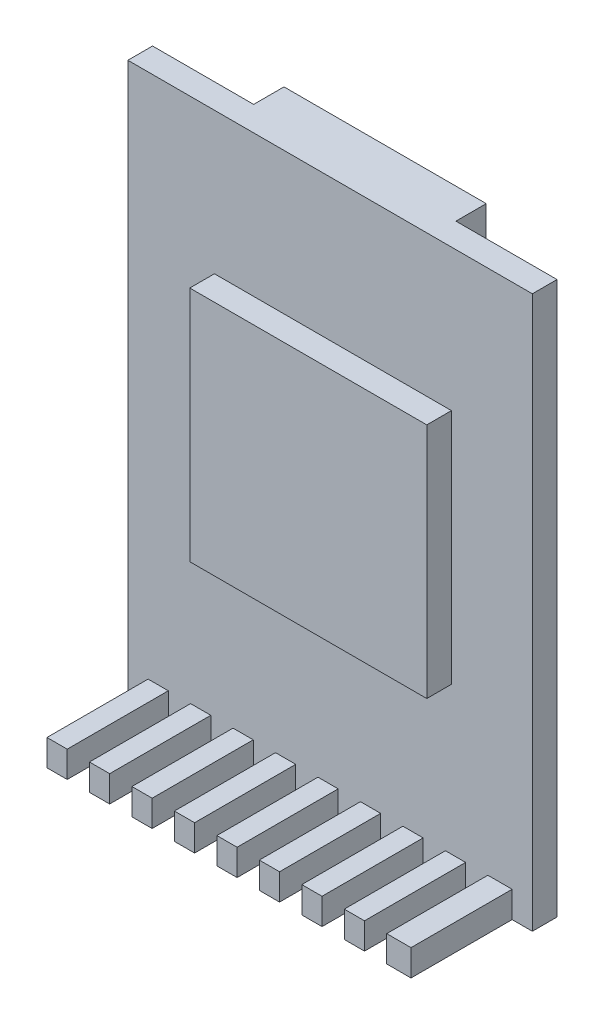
SolidWorks part; units mm, degrees
ref_plane "Front Plane" through (0, 0, 0) normal (0, 0, 1) x (1, 0, 0)
ref_plane "Top Plane" through (0, 0, 0) normal (0, 1, 0) x (1, 0, 0)
ref_plane "Right Plane" through (0, 0, 0) normal (1, 0, 0) x (0, 0, -1)
sketch "Sketch1" plane through (0, 0, 0) normal (0, 0, 1) x (1, 0, 0)
  line L1 (0, 0) -> (25.4, 0)
  line L2 (0, 0) -> (0, 34.671)
  line L3 (0, 34.671) -> (25.4, 34.671)
  line L4 (25.4, 0) -> (25.4, 34.671)
  dimension "D1" = 25.4
  dimension "D2" = 34.671
extrude "Boss-Extrude1" add sketch "Sketch1" along normal blind 1.5494
sketch "Sketch2" plane through (0, 0, 1.5494) normal (0, 0, 1) x (1, 0, 0)
  line L0 (25.4, 0) -> (25.4, 34.671) construction
  line L1 (5.4356, 25.7769) -> (20.32, 25.7769)
  line L2 (5.4356, 25.7769) -> (5.4356, 10.8925)
  line L3 (5.4356, 10.8925) -> (20.32, 10.8925)
  line L4 (20.32, 25.7769) -> (20.32, 10.8925)
  line L5 (5.4356, 25.7769) -> (20.32, 10.8925) construction
  line L6 (5.4356, 10.8925) -> (20.32, 25.7769) construction
  point P0 (12.8778, 18.3347)
  dimension "D1" = 14.8844
  dimension "D2" = 14.8844
  dimension "D3" = 5.08
extrude "Boss-Extrude2" add sketch "Sketch2" along normal blind 1.5494
sketch "Sketch3" plane through (0, 0, 1.5494) normal (0, 0, 1) x (1, 0, 0)
  line L0 (0, 0) -> (25.4, 0) construction
  line L1 (1.27, 0) -> (24.13, 0)
  line L2 (1.27, 0) -> (1.27, 1.651)
  line L3 (1.27, 1.651) -> (24.13, 1.651)
  line L4 (24.13, 0) -> (24.13, 1.651)
  line L5 (25.4, 0) -> (25.4, 34.671) construction
  dimension "D1" = 22.86
  dimension "D2" = 1.27
  dimension "D3" = 1.651
extrude "Boss-Extrude3" add sketch "Sketch3" along normal blind 6.35
sketch "Sketch4" plane through (0, 1.651, 0) normal (0, 1, 0) x (1, 0, 0)
  line L0 (24.13, -7.8994) -> (1.27, -7.8994) construction
  line L1 (2.54, -7.8994) -> (3.937, -7.8994)
  line L2 (2.54, -7.8994) -> (2.54, -1.5494)
  line L3 (2.54, -1.5494) -> (3.937, -1.5494)
  line L4 (3.937, -7.8994) -> (3.937, -1.5494)
  line L5 (24.13, -1.5494) -> (1.27, -1.5494) construction
  line L6 (25.4, -1.5494) -> (0, -1.5494) construction
  line L7 (5.207, -7.8994) -> (6.604, -7.8994)
  line L8 (5.207, -7.8994) -> (5.207, -1.5494)
  line L9 (5.207, -1.5494) -> (6.604, -1.5494)
  line L10 (6.604, -7.8994) -> (6.604, -1.5494)
  line L11 (1.27, -7.8994) -> (1.27, -1.5494) construction
  line L12 (20.32, -1.5494) -> (5.4356, -1.5494) construction
  line L13 (7.874, -7.8994) -> (9.271, -7.8994)
  line L14 (7.874, -7.8994) -> (7.874, -1.5494)
  line L15 (7.874, -1.5494) -> (9.271, -1.5494)
  line L16 (9.271, -7.8994) -> (9.271, -1.5494)
  line L18 (10.541, -7.8994) -> (11.938, -7.8994)
  line L19 (10.541, -7.8994) -> (10.541, -1.5494)
  line L20 (10.541, -1.5494) -> (11.938, -1.5494)
  line L21 (11.938, -7.8994) -> (11.938, -1.5494)
  line L22 (13.208, -7.8994) -> (14.605, -7.8994)
  line L23 (13.208, -7.8994) -> (13.208, -1.5494)
  line L24 (13.208, -1.5494) -> (14.605, -1.5494)
  line L25 (14.605, -7.8994) -> (14.605, -1.5494)
  line L26 (15.875, -7.8994) -> (17.272, -7.8994)
  line L27 (15.875, -7.8994) -> (15.875, -1.5494)
  line L28 (15.875, -1.5494) -> (17.272, -1.5494)
  line L29 (17.272, -7.8994) -> (17.272, -1.5494)
  line L30 (18.542, -7.8994) -> (19.939, -7.8994)
  line L31 (18.542, -7.8994) -> (18.542, -1.5494)
  line L32 (18.542, -1.5494) -> (19.939, -1.5494)
  line L33 (19.939, -7.8994) -> (19.939, -1.5494)
  line L34 (21.209, -7.8994) -> (22.606, -7.8994)
  line L35 (21.209, -7.8994) -> (21.209, -1.5494)
  line L36 (21.209, -1.5494) -> (22.606, -1.5494)
  line L37 (22.606, -7.8994) -> (22.606, -1.5494)
  dimension "D1" = 1.397
  dimension "D2" = 1.397
  dimension "D3" = 1.27
  dimension "D4" = 1.27
  dimension "D5" = 1.397
  dimension "D6" = 1.27
  dimension "D7" = 1.27
  dimension "D8" = 1.397
  dimension "D9" = 1.27
  dimension "D10" = 1.397
  dimension "D11" = 1.27
  dimension "D12" = 1.397
  dimension "D13" = 1.397
  dimension "D14" = 1.397
  dimension "D15" = 1.27
  dimension "D16" = 1.27
extrude "Cut-Extrude1" cut sketch "Sketch4" against normal blind 6.35
sketch "Sketch5" plane through (0, 0, 0) normal (0, 0, -1) x (-1, 0, 0)
  line L0 (0, 34.671) -> (0, 0) construction
  line L1 (-19.05, 27.5117) -> (-19.05, 34.671)
  line L2 (-25.4, 34.671) -> (0, 34.671) construction
  line L3 (-19.05, 34.671) -> (-6.35, 34.671)
  line L4 (-6.35, 34.671) -> (-6.35, 27.5117)
  arc A0 (-19.05, 27.5117) -> (-6.35, 27.5117) centre (-12.7, 27.5117) ccw
  dimension "D1" = 12.7
  dimension "D2" = 12.7
extrude "Boss-Extrude4" add sketch "Sketch5" along normal blind 1.905
